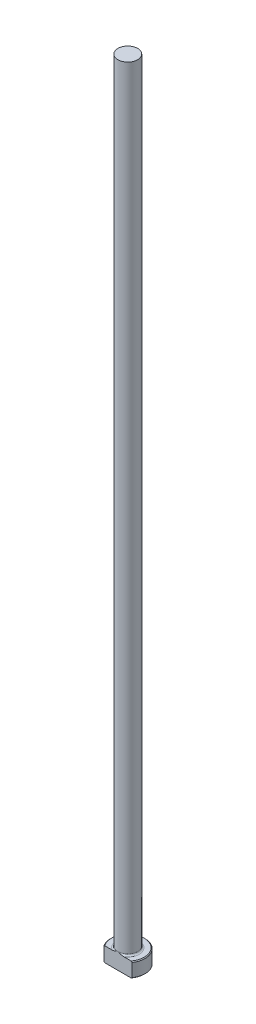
SolidWorks part; units mm, degrees
ref_plane "Front Plane" through (0, 0, 0) normal (0, 0, 1) x (1, 0, 0)
ref_plane "Top Plane" through (0, 0, 0) normal (0, 1, 0) x (1, 0, 0)
ref_plane "Right Plane" through (0, 0, 0) normal (1, 0, 0) x (0, 0, -1)
sketch "Sketch1" plane through (0, 0, 0) normal (0, 0, 1) x (1, 0, 0)
  line L0 (0, 259.9588) -> (0, -15.1925) construction
  line L1 (0, 0) -> (-5.5499, 0)
  line L2 (-5.5499, 0) -> (-5.5499, 4.7498)
  line L3 (-5.5499, 4.7498) -> (-3.175, 4.7498)
  line L4 (-3.175, 4.7498) -> (-3.175, 254)
  line L5 (-3.175, 254) -> (0, 254)
  line L6 (0, 254) -> (0, 0)
  dimension "L" = 254
  dimension "H" = 11.0998
  dimension "T" = 4.7498
  dimension "D" = 6.35
revolve "Revolve1" add sketch "Sketch1" angle 360 about L0
chamfer "Chamfer1" distance 0.254 angle 45 2 edges at (0, 4.7498, 5.5499) (0, 0, 5.5499)
fillet "Fillet1" radius 0.508 1 edges at (0, 4.7498, 3.175)
sketch "Sketch2" plane through (0, 0, 0) normal (0, -1, 0) x (1, 0, 0)
  line L0 (-4.552, 3.175) -> (4.552, 3.175)
  arc A0 (4.552, 3.175) -> (-4.552, 3.175) centre (0, 0) ccw
  circle A1 centre (0, 0) radius 5.5499 construction
  circle A3 centre (0, 0) radius 3.175 construction
extrude "KEY" cut sketch "Sketch2" against normal through all
sketch "Pocket Sketch" plane through (0, 0, 0) normal (0, 0, 1) x (1, 0, 0)
  line L0 (-5.9468, 0) -> (-5.9468, 4.7752)
  line L1 (-5.9468, 4.7752) -> (-4.3339, 4.7752)
  line L2 (-3.5719, 5.5372) -> (-3.5719, 22.225)
  line L3 (-3.5719, 22.225) -> (0, 22.225)
  line L4 (0, 22.225) -> (0, 0)
  line L5 (0, 0) -> (-5.9468, 0)
  line L6 (0, 12.6104) -> (0, -2.4989) construction
  line L7 (-5.5499, 4.4958) -> (-5.5499, 0.254) construction
  line L8 (5.2959, 4.7498) -> (-5.2959, 4.7498) construction
  line L9 (-3.175, 254) -> (-3.175, 5.2578) construction
  line L10 (-4.3339, 4.7752) -> (-3.5719, 5.5372)
  point P3 (-3.5719, 4.7752)
  dimension "D1" = 11.8935
  dimension "D2" = 0.3969
  dimension "D3" = 0.0254
  dimension "D4" = 0.3969
  dimension "D5" = 7.1437
  dimension "D6" = 22.225
